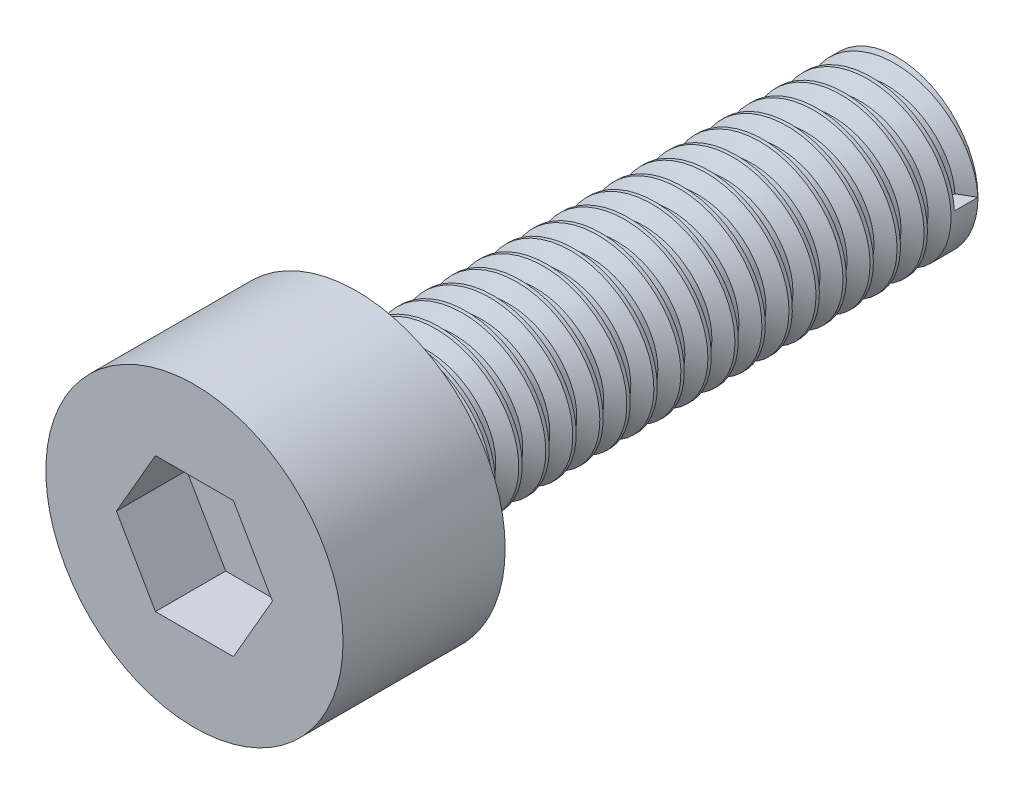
SolidWorks part; units mm, degrees
ref_plane "Front Plane" through (0, 0, 0) normal (0, 0, 1) x (1, 0, 0)
ref_plane "Top Plane" through (0, 0, 0) normal (0, 1, 0) x (1, 0, 0)
ref_plane "Right Plane" through (0, 0, 0) normal (1, 0, 0) x (0, 0, -1)
sketch "Sketch1" plane through (0, 0, 0) normal (0, 0, 1) x (1, 0, 0)
  circle A0 centre (0, 0) radius 1.5
  dimension "D1" = 3
extrude "Boss-Extrude1" add sketch "Sketch1" against normal blind 10
sketch "Sketch2" plane through (0, 0, 0) normal (0, 0, 1) x (1, 0, 0)
  circle A0 centre (0, 0) radius 2.75
  dimension "D1" = 5.5
extrude "Boss-Extrude2" add sketch "Sketch2" along normal blind 3
ref_plane "Mat_dau_vit" through (0, 0, 3) normal (0, 0, 1) x (1, 0, 0)
sketch "Sketch3" plane through (0, 0, 3) normal (0, 0, 1) x (1, 0, 0)
  line L1 (1.4434, 0) -> (0.7217, 1.25)
  line L2 (0.7217, 1.25) -> (-0.7217, 1.25)
  line L3 (-0.7217, 1.25) -> (-1.4434, 0)
  line L4 (-1.4434, 0) -> (-0.7217, -1.25)
  line L5 (-0.7217, -1.25) -> (0.7217, -1.25)
  line L6 (0.7217, -1.25) -> (1.4434, 0)
  circle A0 centre (0, 0) radius 1.25 construction
  dimension "D1" = 2.5
extrude "Cut-Extrude1" cut sketch "Sketch3" against normal blind 1.3
thread "Ren_ngoai_M3x0_5" pitch 0.5 start angle 0, offset 0, length 0, pitch 0.5, diameter 3
ref_plane "Plane2" through (1.5, 0, -10) normal (0, -1, 0) x (1, 0, 0)
sketch "Thread Profile1" plane through (1.5, 0, -10) normal (0, -1, 0) x (1, 0, 0)
  line L0 (0, 0) -> (0, 0.5) construction
  line L11 (0, 0) -> (0, 0.4375)
  line L12 (0, 0.4375) -> (-0.2706, 0.2812)
  line L13 (-0.2706, 0.2812) -> (-0.2706, 0.1562)
  line L15 (-0.2706, 0.1562) -> (0, 0)
  line L17 (-0.2706, 0.2187) -> (0, 0.2187) construction
  point P2 (0, 0)
  dimension "Pitch" = 0.5
  dimension "Profile_Angle" = 60
  dimension "Profile_Land" = 0.125
  dimension "Profile_Height" = 0.2706
